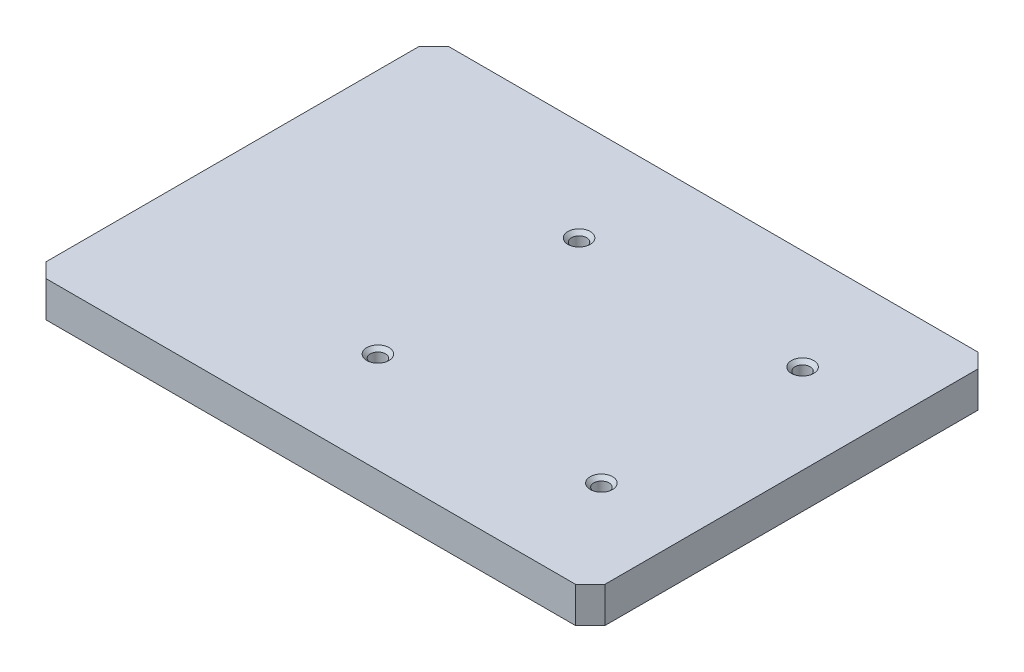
SolidWorks part; units mm, degrees
ref_plane "Front" through (0, 0, 0) normal (0, 0, 1) x (1, 0, 0)
ref_plane "Top" through (0, 0, 0) normal (0, 1, 0) x (1, 0, 0)
ref_plane "Right" through (0, 0, 0) normal (1, 0, 0) x (0, 0, -1)
sketch "Sketch1" plane through (0, 0, 0) normal (0, 1, 0) x (1, 0, 0)
  line L1 (125, -90) -> (-125, -90)
  line L2 (125, -90) -> (125, 90)
  line L3 (125, 90) -> (-125, 90)
  line L4 (-125, -90) -> (-125, 90)
  line L5 (125, -90) -> (-125, 90) construction
  line L6 (125, 90) -> (-125, -90) construction
  point P0 (0, 0)
  dimension "D1" = 250
  dimension "D2" = 180
extrude "Boss-Extrude1" add sketch "Sketch1" along normal blind 16
hole_wizard "M8 Tapped Hole1" positions "Sketch2" profile "Sketch3" tap size "M8" standard "ISO"
sketch "Sketch2" plane through (0, 16, 0) normal (0, 1, 0) x (1, 0, 0)
  line L1 (-15, 45) -> (85, 45) construction
  line L2 (-15, 45) -> (-15, -45) construction
  line L3 (-15, -45) -> (85, -45) construction
  line L4 (85, 45) -> (85, -45) construction
  line L5 (125, 0) -> (85, 0) construction
  line L6 (125, -90) -> (125, 90) construction
  point P0 (85, -45)
  point P2 (-15, -45)
  point P4 (-15, 45)
  point P6 (85, 45)
  dimension "D1" = 40
  dimension "D2" = 90
  dimension "D3" = 100
sketch "Sketch3" plane through (85, 16, 45) normal (1, 0, 0) x (0, 0, 1)
  line L0 (0, 0) -> (0, 16)
  line L1 (0, 16) -> (3.4, 16)
  line L2 (3.4, 16) -> (3.4, 1.6)
  line L3 (3.4, 1.6) -> (5, 0)
  line L5 (5, 0) -> (0, 0)
  line L6 (-3.4, 1.6) -> (-5, 0) construction
  line L11 (0, -6.35) -> (0, 107.95) construction
  dimension "Thru Tap Drill Dia." = 6.8
  dimension "Thru Tap Drill Depth" = 16
  dimension "Near C'Sink Dia." = 10
  dimension "Near C'Sink Angle" = 90
chamfer "Chamfer1" distance 6.5 angle 45 4 edges at (-125, 8, -90) (-125, 8, 90) (125, 8, -90) (125, 8, 90)
